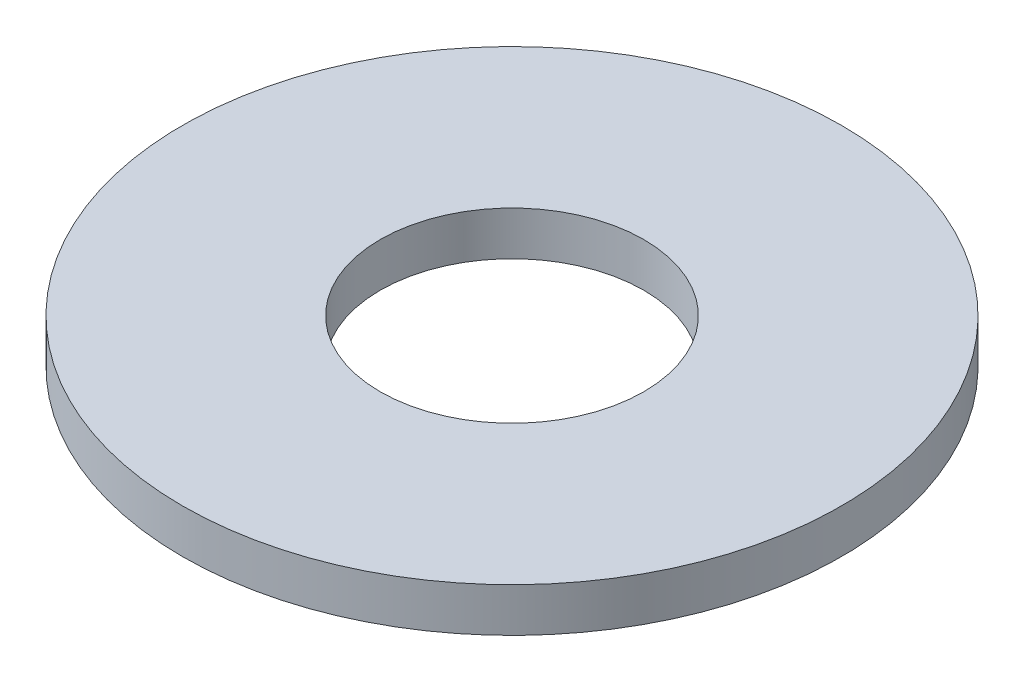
SolidWorks part; units mm, degrees
ref_plane "Front" through (0, 0, 0) normal (0, 0, 1) x (1, 0, 0)
ref_plane "Top" through (0, 0, 0) normal (0, 1, 0) x (1, 0, 0)
ref_plane "Right" through (0, 0, 0) normal (1, 0, 0) x (0, 0, -1)
sketch "Sketch1" plane through (0, 0, 0) normal (0, 1, 0) x (1, 0, 0)
  circle A0 centre (0, 0) radius 0.9
  circle A1 centre (0, 0) radius 2.25
extrude "Extrude1" add sketch "Sketch1" along normal blind 0.3
